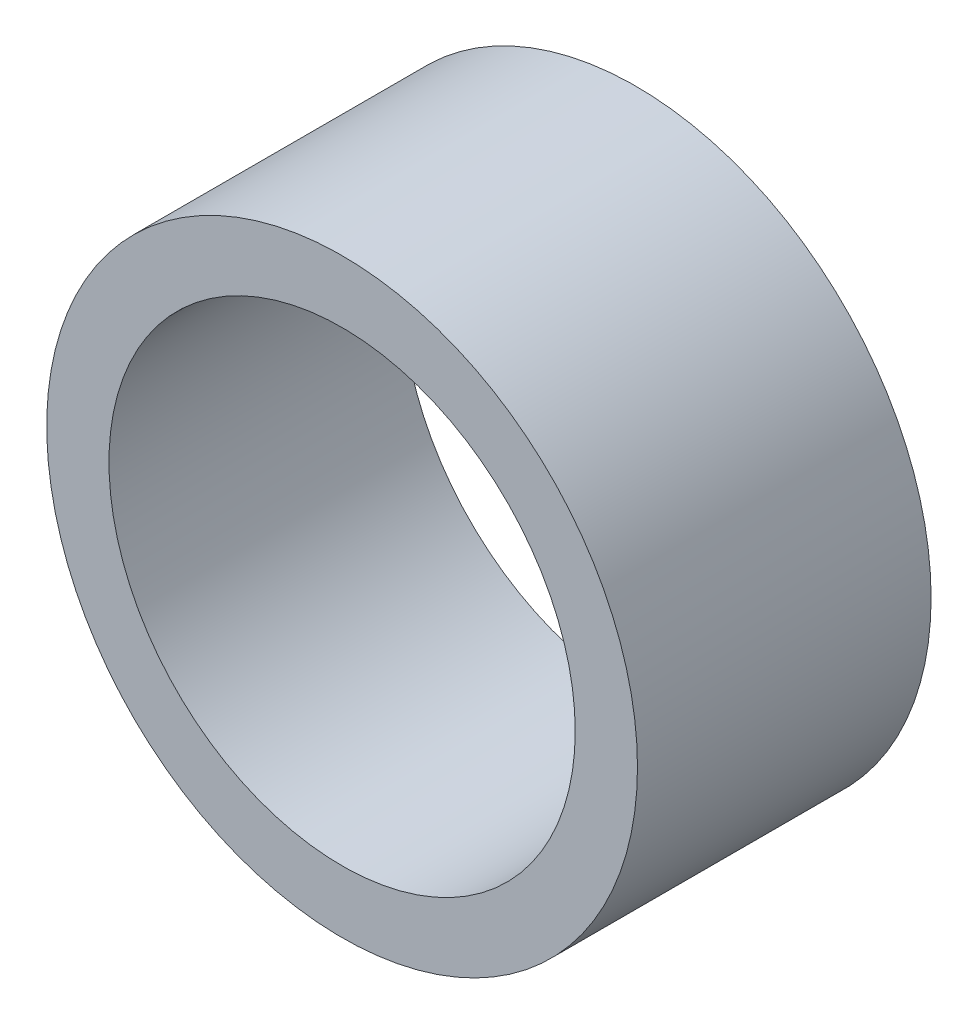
SolidWorks part; units mm, degrees
ref_plane "Front Plane" through (0, 0, 0) normal (0, 0, 1) x (1, 0, 0)
ref_plane "Top Plane" through (0, 0, 0) normal (0, 1, 0) x (1, 0, 0)
ref_plane "Right Plane" through (0, 0, 0) normal (1, 0, 0) x (0, 0, -1)
sketch "Sketch1" plane through (0, 0, 0) normal (0, 0, 1) x (1, 0, 0)
  circle A0 centre (0, 0) radius 198.5
  circle A1 centre (0, 0) radius 251.5
  dimension "D1" = 503
  dimension "D2" = 397
extrude "Extrude1" add sketch "Sketch1" along normal up to surface (250 mm away)
